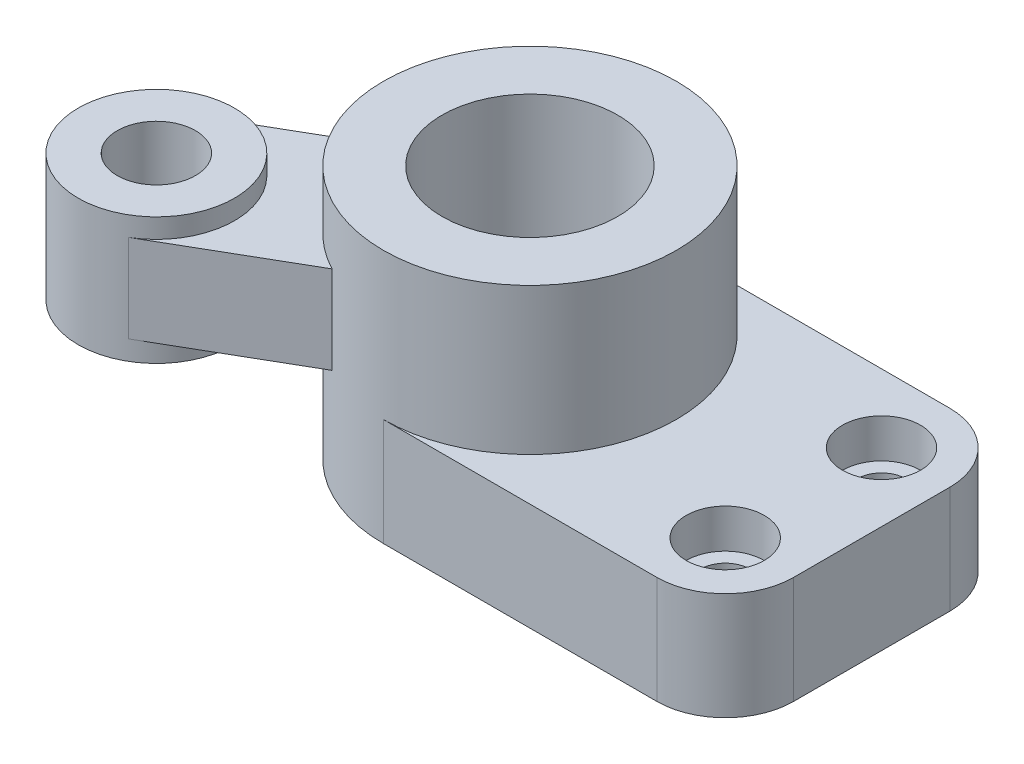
SolidWorks part; units mm, degrees
ref_plane "前视基准面" through (0, 0, 0) normal (0, 0, 1) x (1, 0, 0)
ref_plane "上视基准面" through (0, 0, 0) normal (0, 1, 0) x (1, 0, 0)
ref_plane "右视基准面" through (0, 0, 0) normal (1, 0, 0) x (0, 0, -1)
sketch "草图1" plane through (0, 0, 0) normal (0, 1, 0) x (1, 0, 0)
  line L0 (-52.0449, 0) -> (85.4564, 0) construction
  line L1 (0, 61.2009) -> (0, -69.8751) construction
  line L2 (0, 15) -> (35, 15)
  line L3 (35, 15) -> (35, -15)
  line L4 (24.7709, 8) -> (50.1569, 8) construction
  line L5 (28, 19.017) -> (28, 4.1211) construction
  line L6 (0, -15) -> (35, -15)
  circle A0 centre (0, 0) radius 9
  arc A1 (0, 15) -> (0, -15) centre (0, 0) ccw
  circle A2 centre (28, 8) radius 2.5
  circle A3 centre (28, -8) radius 2.5
  point P21 (35, 0)
  dimension "D1" = 18
  dimension "D2" = 30
  dimension "D6" = 5
  dimension "D3" = 35
  dimension "D4" = 28
  dimension "D5" = 8
extrude "凸台-拉伸1" add sketch "草图1" along normal blind 11
sketch "草图2" plane through (0, 11, 0) normal (0, 1, 0) x (1, 0, 0)
  circle A0 centre (28, 8) radius 4
  circle A1 centre (28, -8) radius 4
  dimension "D1" = 8
  dimension "D2" = 8
extrude "切除-拉伸1" cut sketch "草图2" against normal blind 4
sketch "草图3" plane through (0, 11, 0) normal (0, 1, 0) x (1, 0, 0)
  circle A0 centre (0, 0) radius 9
  circle A1 centre (0, 0) radius 15
extrude "凸台-拉伸2" add sketch "草图3" along normal blind 15
ref_plane "基准面1" through (0, 9, 0) normal (0, 1, 0) x (-1, 0, 0)
ref_plane "基准面2" through (0, 22, 0) normal (0, 1, 0) x (-1, 0, 0)
sketch "草图4"
  dimension "D2" = 8
  dimension "D3" = 16
  dimension "D1" = 30
  dimension "D4" = 28
extrude "凸台-拉伸3" add sketch "草图4" along normal up to surface (13 mm away) separate body
ref_plane "基准面3" through (0, 11, 0) normal (0, 1, 0) x (-1, 0, 0)
ref_plane "基准面4" through (0, 20, 0) normal (0, 1, 0) x (-1, 0, 0)
sketch "草图5" plane through (0, 11, 0) normal (0, 1, 0) x (-1, 0, 0)
  line L0 (0, 0) -> (24.2487, 14) construction
  line L1 (20.2118, 20.9067) -> (6.9887, 13.2724)
  line L2 (28.2117, 7.0505) -> (14.9886, -0.5838)
  circle A0 centre (24.2487, 14) radius 8 construction
  arc A1 (20.2118, 20.9067) -> (28.2117, 7.0505) centre (24.2487, 14) ccw
  arc A2 (14.9886, -0.5838) -> (6.9887, 13.2724) centre (0, 0) ccw
extrude "凸台-拉伸4" add sketch "草图5" along normal up to surface (9 mm away)
fillet "圆角1" radius 7 2 edges at (35, 5.5, -15) (35, 5.5, 15)
